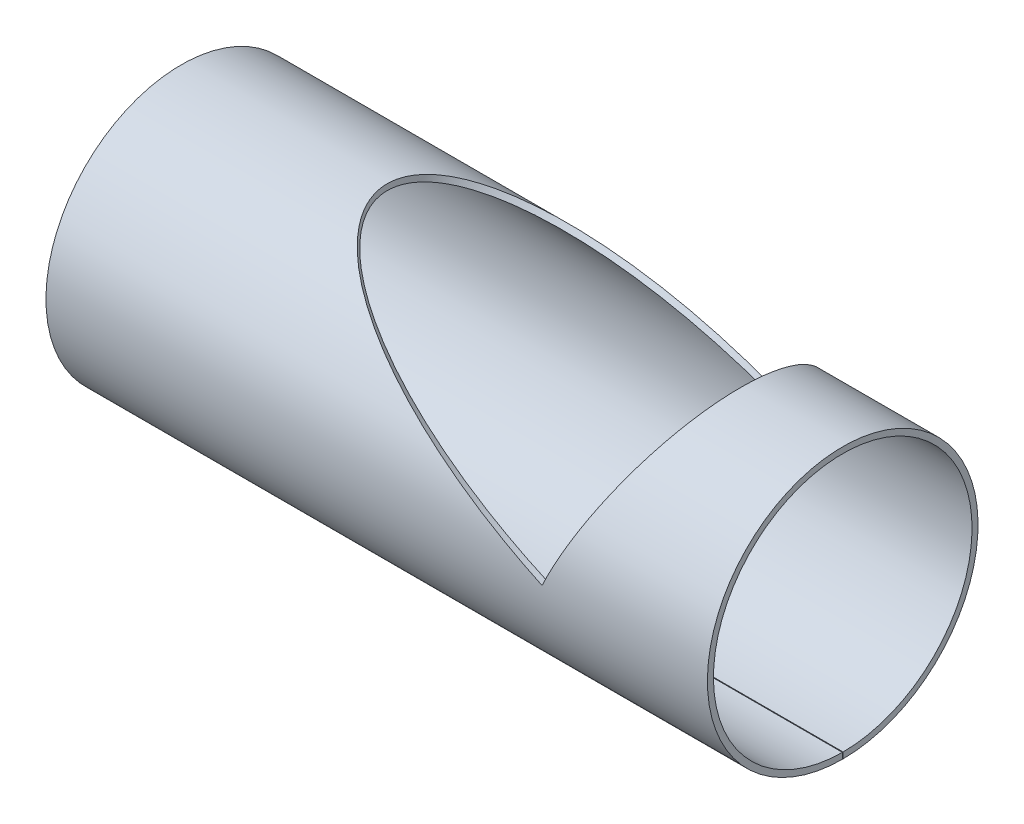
SolidWorks part; units mm, degrees
ref_plane "前视基准面" through (0, 0, 0) normal (0, 0, 1) x (1, 0, 0)
ref_plane "上视基准面" through (0, 0, 0) normal (0, 1, 0) x (1, 0, 0)
ref_plane "右视基准面" through (0, 0, 0) normal (1, 0, 0) x (0, 0, -1)
imported_body "基体零件-等径斜交三通管-1"
sheet metal parameters "钣金1" parameters "D1"=0.7366, "厚度"=8
bend "圆角折弯1" bend radius 172 bend angle 359.682 parameters "D5"=1
flatten bends "展开-折弯1"
sketch "尖角-草图1" plane through (-220, -179.9993, -0.5) normal (0, -1, -0.0028) x (1, 0, 0)
  line L0 (440, -539.8762) -> (-440, -539.8762) construction
  dimension "D1" = 0
process bends "加工-折弯1" parameters "D1"=0
sketch "平面-草图1" plane through (-220, -179.9993, -0.5) normal (0, -1, -0.0028) x (1, 0, 0)
